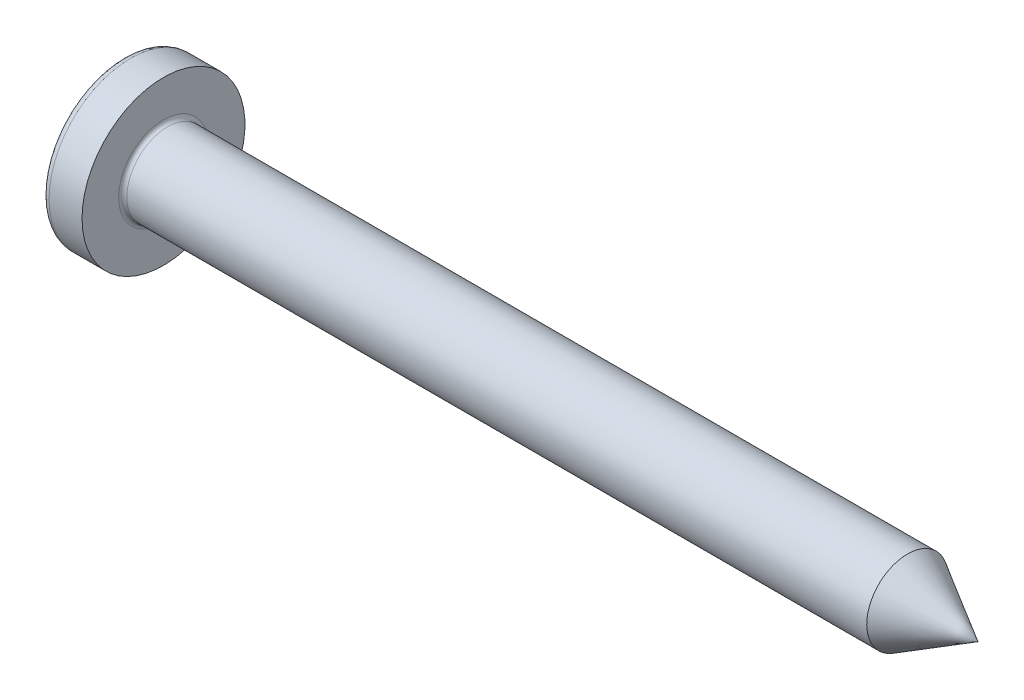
SolidWorks part; units mm, degrees
ref_plane "Plane1" through (0, 0, 0) normal (0, 0, 1) x (1, 0, 0)
ref_plane "Plane2" through (0, 0, 0) normal (0, 1, 0) x (1, 0, 0)
ref_plane "Plane3" through (0, 0, 0) normal (1, 0, 0) x (0, 0, -1)
revolve "Base-Revolve" add sketch "BodySke"
sketch "BodySke" plane through (0, 0, 0) normal (0, 0, 1) x (1, 0, 0)
  line L0 (1.6, 1) -> (1.6, 2)
  line L1 (1.8, 6.35) -> (1.8, -3.175) construction
  line L2 (-25.4, 0) -> (127, 0) construction
  line L3 (21.6, 0) -> (0, 0)
  line L4 (1.6, 1) -> (21.6, 1)
  line L5 (21.6, 1) -> (21.6, 0)
  line L6 (0.79, 2) -> (1.6, 2)
  line L8 (1.6, 6.35) -> (1.6, -3.175) construction
  arc A0 (0.6464, 1.9285) -> (0, 0) centre (3.2, 0) ccw
  arc A2 (0.6464, 1.9285) -> (0.79, 2) centre (0.79, 1.82) cw
  dimension "Head_fillet_rad" = 0.18
  dimension "Head_crown_rad" = 3.2
  dimension "Head_ht" = 1.6
  dimension "Diameter" = 2
  dimension "Length" = 20
  dimension "Head_dia" = 4
  dimension "Advance" = 0.4
  dimension "Thread_nom" = 20
fillet "Fillet1" radius 0.1 1 edges at (1.6, 0, 1)
sketch "Sketch3" plane through (0, 0, 0) normal (1, 0, 0) x (0, 0, -1)
  line L0 (0.24, -1.05) -> (-0.24, -1.05)
  line L1 (0.24, -1.05) -> (0.24, 1.05)
  line L2 (-0.24, 1.05) -> (0.24, 1.05)
  line L3 (-0.24, 1.05) -> (-0.24, -1.05)
  dimension "D1" = 1.05
  dimension "Cross_dia" = 2.1
  dimension "D2" = 0.24
  dimension "Cross_width" = 0.48
ref_plane "Plane4" through (1.42, 0, 0) normal (1, 0, 0) x (0, 0, -1)
sketch "Sketch4" plane through (1.42, 0, 0) normal (1, 0, 0) x (0, 0, -1)
  line L0 (0.24, -0.342) -> (-0.24, -0.342)
  line L1 (0.24, -0.342) -> (0.24, 0.342)
  line L2 (-0.24, 0.342) -> (0.24, 0.342)
  line L3 (-0.24, 0.342) -> (-0.24, -0.342)
  dimension "D1" = 0.48
  dimension "D2" = 0.684
  dimension "D3" = 0.24
  dimension "D4" = 0.342
loft "Recess" cut profiles "Sketch3", "Sketch4"
pattern_circular "RecPat" count 2 every 90 about axis through (0, 0, 0) along (1, 0, 0) of "Recess"
sketch "RecCorSke" plane through (0, 0, 0) normal (0, 0, 1) x (1, 0, 0)
  line L0 (-3.175, 0) -> (15.875, 0) construction
  line L1 (-25.4, 0) -> (127, 0) construction
  line L2 (0, 0) -> (0, 0.4548)
  line L3 (0, 0.4548) -> (1.42, 0.3555)
  line L4 (1.42, 0.3555) -> (1.5355, 0)
  line L5 (1.5355, 0) -> (0, 0)
  dimension "Diameter" = 0.711
  dimension "Depth" = 1.42
  dimension "Draft_angle" = 4
  dimension "Bottom_angle" = 18
revolve "RecessCore" cut sketch "RecCorSke" angle 360 about L0
sketch "ThdSchSke" plane through (0, 0, 0) normal (0, 0, 1) x (1, 0, 0)
  line L0 (2.4, -0.774) -> (2.2418, -1)
  line L1 (2.4, -0.774) -> (2.5582, -1)
  line L2 (2.5582, -1) -> (2.5582, -1.25)
  line L3 (-3.175, 0) -> (5.1513, 0) construction
  line L5 (2.5582, -1.25) -> (2.2418, -1.25)
  line L6 (2.2418, -1.25) -> (2.2418, -1)
  dimension "Thread_minor" = 1.548
  dimension "Diameter" = 2
  dimension "Start" = 2.4
  dimension "SideAngle" = 55
  dimension "VeeAngle" = 70
  dimension "Overcut" = 2.5
revolve "ThreadSchematic" [suppressed] cut sketch "ThdSchSke" angle 360 about L3
pattern_linear "ThdSchPat" [suppressed]
chamfer "Chanfrein1" distance 1 angle 60 1 edges at (21.6, 0, 1)
equation "\"D1@Sketch3\" = \"Cross_dia@Sketch3\" / 2"
equation "\"D2@Sketch3\" = \"Cross_width@Sketch3\" / 2"
equation "\"Depth@RecCorSke\" = \"Cross_depth@Plane4\""
equation "\"D1@Sketch4\" = \"Cross_width@Sketch3\""
equation "\"D2@Sketch4\" = \"Cross_dia@Sketch3\" - 2.0 * \"Cross_depth@Plane4\" * tan(26.5  * 0.017453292)"
equation "\"D3@Sketch4\" = \"D1@Sketch4\" / 2"
equation "\"D4@Sketch4\" = \"D2@Sketch4\" / 2"
equation "\"Thread_length@ThreadCosmetic\" = ((sgn( (\"Length@BodySke\" - \"Advance@BodySke\" * 2.0 ) - \"Thread_nom@BodySke\" )-1)*( (\"Length@BodySke\" - \"Advance@BodySke\" * 2.0 ) - \"Thread_nom@BodySke\" ))/-2+ \"Thread_"
equation "\"Thread_minor@ThdSchSke\" = \"Thread_minor@ThreadCosmetic\""
equation "\"Diameter@ThdSchSke\" = \"Diameter@BodySke\""
equation "\"Overcut@ThdSchSke\" = \"Diameter@BodySke\" * 1.25"
equation "\"Start@ThdSchSke\" = \"Head_ht@BodySke\" + \"Length@BodySke\" - \"Thread_length@ThreadCosmetic\"  '---Non-countersunk---"
equation "\"Num_threads@ThdSchPat\" = int( \"Thread_length@ThreadCosmetic\" / \"Advance@BodySke\" + 0.999 )  + 1"
equation "\"Advance@ThdSchPat\" = \"Thread_length@ThreadCosmetic\" /  (\"Num_threads@ThdSchPat\" - 1) 'relax it"
